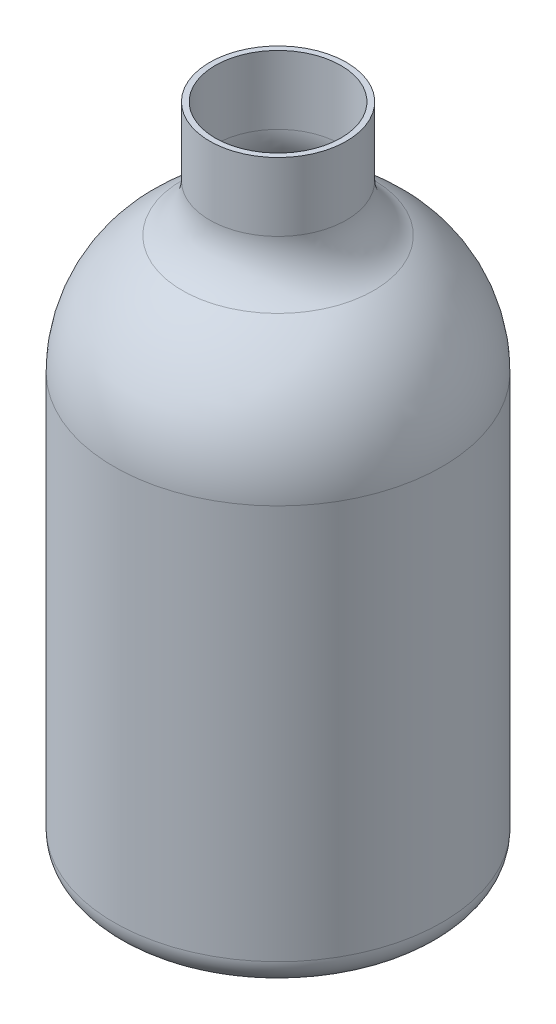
SolidWorks part; units mm, degrees
ref_plane "Front Plane" through (0, 0, 0) normal (0, 0, 1) x (1, 0, 0)
ref_plane "Top Plane" through (0, 0, 0) normal (0, 1, 0) x (1, 0, 0)
ref_plane "Right Plane" through (0, 0, 0) normal (1, 0, 0) x (0, 0, -1)
sketch "Sketch1" plane through (0, 0, 0) normal (0, 0, 1) x (1, 0, 0)
  line L0 (0, 0) -> (50, 0)
  line L1 (60, 10) -> (60, 154.3782)
  line L2 (0, 0) -> (0, 240) construction
  line L3 (0, 240) -> (0, 0)
  line L7 (0, 240) -> (25, 240)
  line L8 (25, 240) -> (25, 215)
  arc A0 (60, 154.3782) -> (35, 197.6795) centre (10, 154.3782) ccw
  arc A1 (35, 197.6795) -> (25, 215) centre (45, 215) cw
  arc A2 (50, 0) -> (60, 10) centre (50, 10) ccw
  point P11 (60, 0)
  dimension "D1" = 20
  dimension "D5" = 50
  dimension "D7" = 10
  dimension "D2" = 60
  dimension "D3" = 25
  dimension "D4" = 240
  dimension "D6" = 25
revolve "Revolve1" add sketch "Sketch1" angle 360 about L2
sketch "Sketch6" plane through (0, 0, 0) normal (0, 0, 1) x (1, 0, 0)
  line L5 (0, 0) -> (50, 0)
  line L6 (60, 10) -> (60, 154.3782)
  line L7 (25, 215) -> (25, 240)
  line L8 (25, 240) -> (0, 240)
  line L9 (0, 240) -> (0, 0)
  line L11 (60, 10) -> (60, 154.3782)
  arc A2 (60, 154.3782) -> (35, 197.6795) centre (10, 154.3782) ccw
  arc A3 (25, 215) -> (35, 197.6795) centre (45, 215) ccw
  arc A4 (60, 154.3782) -> (35, 197.6795) centre (10, 154.3782) ccw
  arc A7 (50, 0) -> (60, 10) centre (50, 10) ccw
  dimension "D1" = 0
ref_plane "Plane1" through (60, 10, 0) normal (0, 1, 0) x (-1, 0, 0)
sketch "Sketch9" plane through (60, 10, 0) normal (0, 1, 0) x (-1, 0, 0)
  circle A0 centre (0, 0) radius 5
  dimension "D1" = 10
sweep "Cut-Sweep5" cut profiles "Sketch9" path "Sketch6"
shell "Shell1" thickness 2
